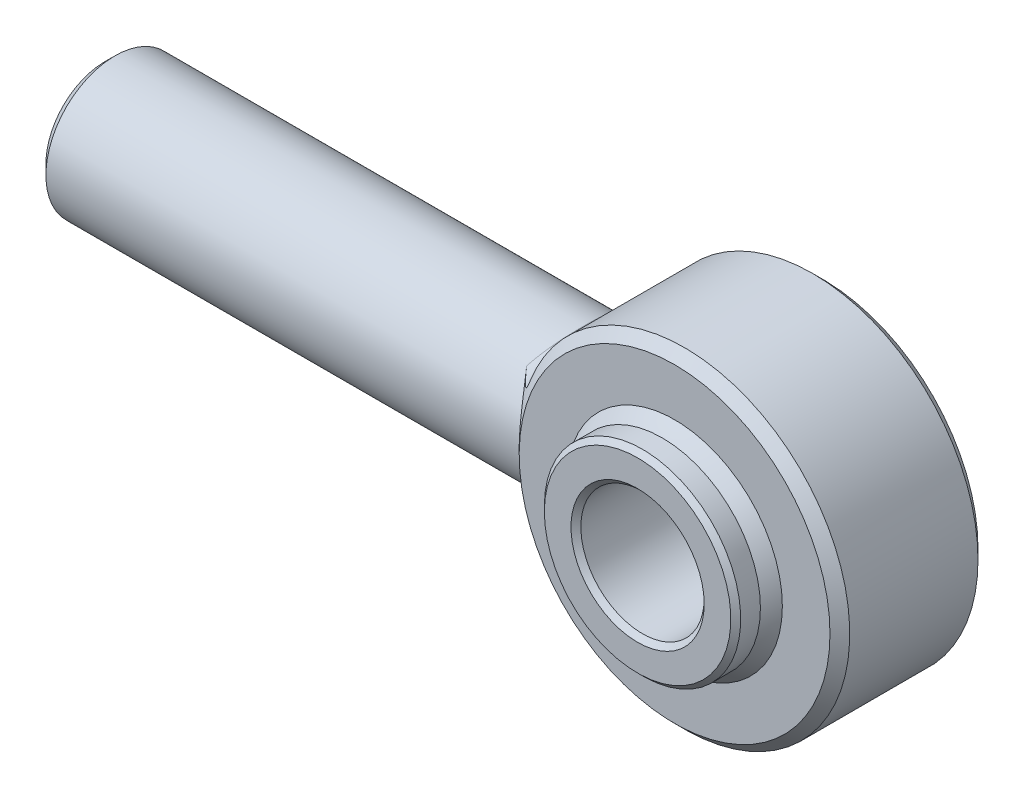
SolidWorks part; units mm, degrees
ref_plane "Plan de face" through (0, 0, 0) normal (0, 0, 1) x (1, 0, 0)
ref_plane "Plan de dessus" through (0, 0, 0) normal (0, 1, 0) x (1, 0, 0)
ref_plane "Plan de droite" through (0, 0, 0) normal (1, 0, 0) x (0, 0, -1)
sketch "Esquisse1" plane through (0, 0, 0) normal (0, 0, 1) x (1, 0, 0)
  line L0 (-56.6114, 0) -> (67.1683, 0) construction
  line L1 (-26.5, 0) -> (26.5, 0)
  arc A0 (26.5, 0) -> (-26.5, 0) centre (0, 0) ccw
  dimension "D1" = 26.5
revolve "Révolution2" add sketch "Esquisse1" angle 360 about L0
sketch "Esquisse2" plane through (0, 0, 0) normal (0, 0, 1) x (1, 0, 0)
  line L0 (-58, 53.1118) -> (-58, -50.061) construction
  line L1 (-85.0066, 0) -> (54.7759, 0) construction
  circle A0 centre (0, 0) radius 33.5
  dimension "D1" = 67
  dimension "D2" = 58
extrude "Extrusion1" add sketch "Esquisse2" along normal mid plane 30
chamfer "Chanfrein1" distance 2 angle 45 2 edges at (33.5, 0, -15) (33.5, 0, 15)
sketch "Esquisse3" plane through (0, 0, 0) normal (1, 0, 0) x (0, 0, -1)
  line L1 (-17.5, 40) -> (17.5, 40)
  line L2 (-17.5, 40) -> (-17.5, -40)
  line L3 (-17.5, -40) -> (17.5, -40)
  line L4 (17.5, 40) -> (17.5, -40)
  dimension "D1" = 40
  dimension "D2" = 40
  dimension "D3" = 17.5
  dimension "D4" = 17.5
extrude "Enlèv. mat.-Extru.1" cut sketch "Esquisse3" against normal mid plane 70 flip side to cut
sketch "Esquisse4" plane through (0, 0, -17.5) normal (0, 0, -1) x (-1, 0, 0)
  circle A0 centre (0, 0) radius 12.5
  dimension "D1" = 25
extrude "Enlèv. mat.-Extru.2" cut sketch "Esquisse4" against normal through all
sketch "Esquisse5" plane through (0, 0, 17.5) normal (0, 0, 1) x (1, 0, 0)
  circle A0 centre (0, 0) radius 19.8997
  circle A1 centre (0, 0) radius 12.5
extrude "Extrusion2" add sketch "Esquisse5" along normal blind 5
chamfer "Chanfrein3" distance 1 angle 45 2 edges at (12.5, 0, 22.5) (19.8997, 0, 22.5)
sketch "Esquisse6" plane through (0, 0, -17.5) normal (0, 0, -1) x (-1, 0, 0)
  circle A0 centre (0, 0) radius 12.5
  circle A1 centre (0, 0) radius 19.8997
extrude "Extrusion3" add sketch "Esquisse6" along normal blind 5
chamfer "Chanfrein4" distance 1 angle 45 2 edges at (0, 12.5, -22.5) (0, 19.8997, -22.5)
sketch "Esquisse7" plane through (0, 0, 0) normal (0, 0, 1) x (1, 0, 0)
  line L0 (0, 0) -> (-124.2942, 0) construction
  line L1 (-130.4344, 14) -> (-30.4344, 14)
  line L2 (-130.4344, 14) -> (-130.4344, 0)
  line L3 (-30.4344, 14) -> (-30.4344, 0)
  line L4 (-130.4344, 0) -> (-30.4344, 0)
  circle A0 centre (0, 0) radius 33.5 construction
  dimension "D1" = 28
  dimension "D2" = 100
revolve "Révolution3" add sketch "Esquisse7" angle 360 about L0
chamfer "Chanfrein5" distance 2 angle 45 1 edges at (-130.4344, 0, -14)
fillet "Congé1" radius 5 2 edges at (-30.6412, -13.5414, 3.5541) (-30.4812, 13.8976, -1.6898)
